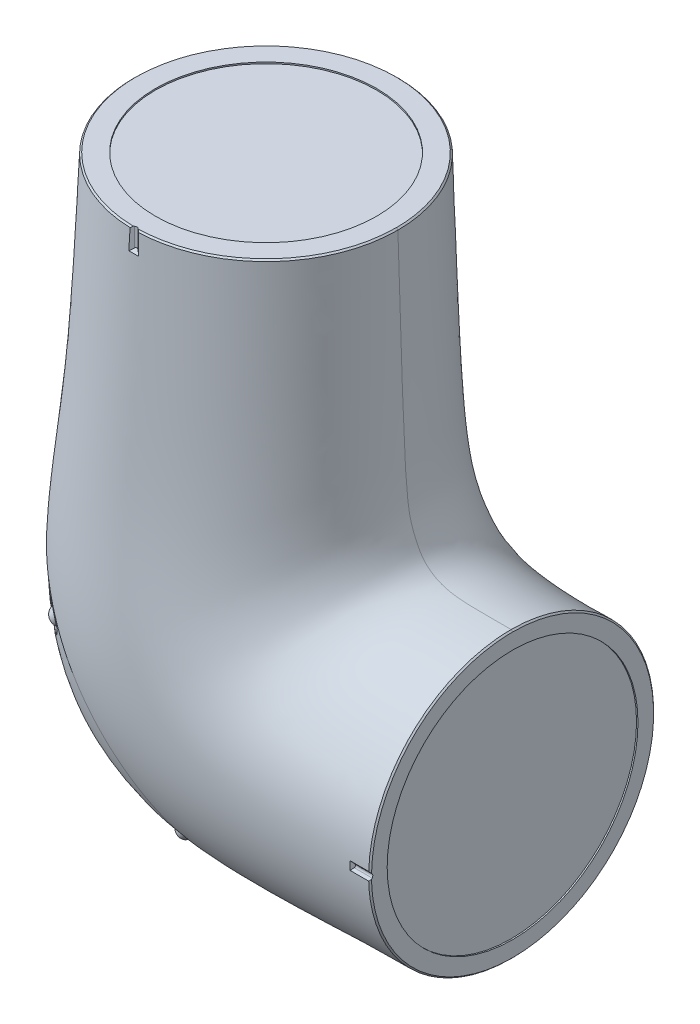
SolidWorks part; units mm, degrees
ref_plane "前视基准面" through (0, 0, 0) normal (0, 0, 1) x (1, 0, 0)
ref_plane "上视基准面" through (0, 0, 0) normal (0, 1, 0) x (1, 0, 0)
ref_plane "右视基准面" through (0, 0, 0) normal (1, 0, 0) x (0, 0, -1)
imported_body "输入2"
sketch "草图1" plane through (86.5, 0, 0) normal (1, 0, 0) x (0, 0, -1)
  circle A0 centre (0, 0) radius 43.9991
extrude "切除-拉伸1" cut sketch "草图1" against normal blind 0.5
sketch "草图2" plane through (0, 152, 0) normal (0, 1, 0) x (1, 0, 0)
  circle A0 centre (0, 0) radius 38.8238
extrude "切除-拉伸2" cut sketch "草图2" against normal blind 0.5
